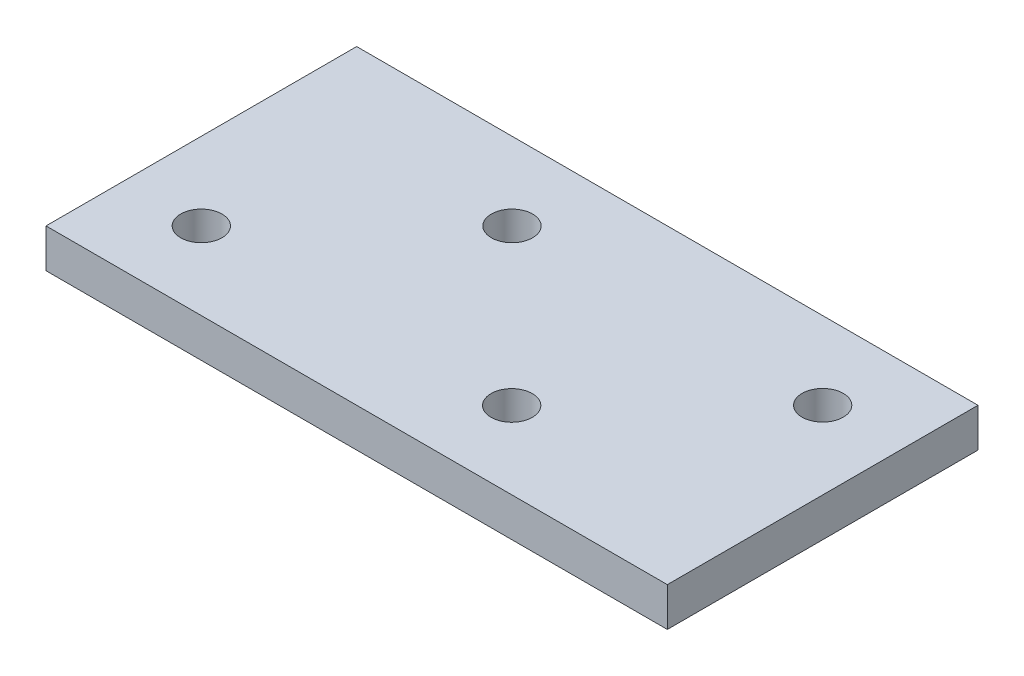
SolidWorks part; units mm, degrees
ref_plane "Front" through (0, 0, 0) normal (0, 0, 1) x (1, 0, 0)
ref_plane "Top" through (0, 0, 0) normal (0, 1, 0) x (1, 0, 0)
ref_plane "Right" through (0, 0, 0) normal (1, 0, 0) x (0, 0, -1)
sketch "Sketch1" plane through (0, 0, 0) normal (0, 1, 0) x (1, 0, 0)
  line L0 (0, 25.4) -> (101.6, 25.4) construction
  line L1 (0, 0) -> (101.6, 0)
  line L2 (0, 0) -> (0, 50.8)
  line L3 (0, 50.8) -> (101.6, 50.8)
  line L4 (101.6, 0) -> (101.6, 50.8)
  line L5 (38.1, 38.1) -> (118.3211, 38.1) construction
  line L6 (12.7, 12.7) -> (105.7547, 12.7) construction
  circle A0 centre (12.7, 12.7) radius 3.3731
  circle A1 centre (38.1, 38.1) radius 3.3731
  circle A2 centre (88.9, 38.1) radius 3.3731
  circle A3 centre (63.5, 12.6466) radius 3.3731
  dimension "D3" = 6.7462
  dimension "D8" = 12.7
  dimension "D9" = 25.4
  dimension "D10" = 12.7
  dimension "D1" = 50.8
  dimension "D2" = 101.6
  dimension "D4" = 12.7
  dimension "D5" = 12.7
  dimension "D6" = 12.7
  dimension "D7" = 38.1
extrude "Extrude1" add sketch "Sketch1" along normal blind 6.35
